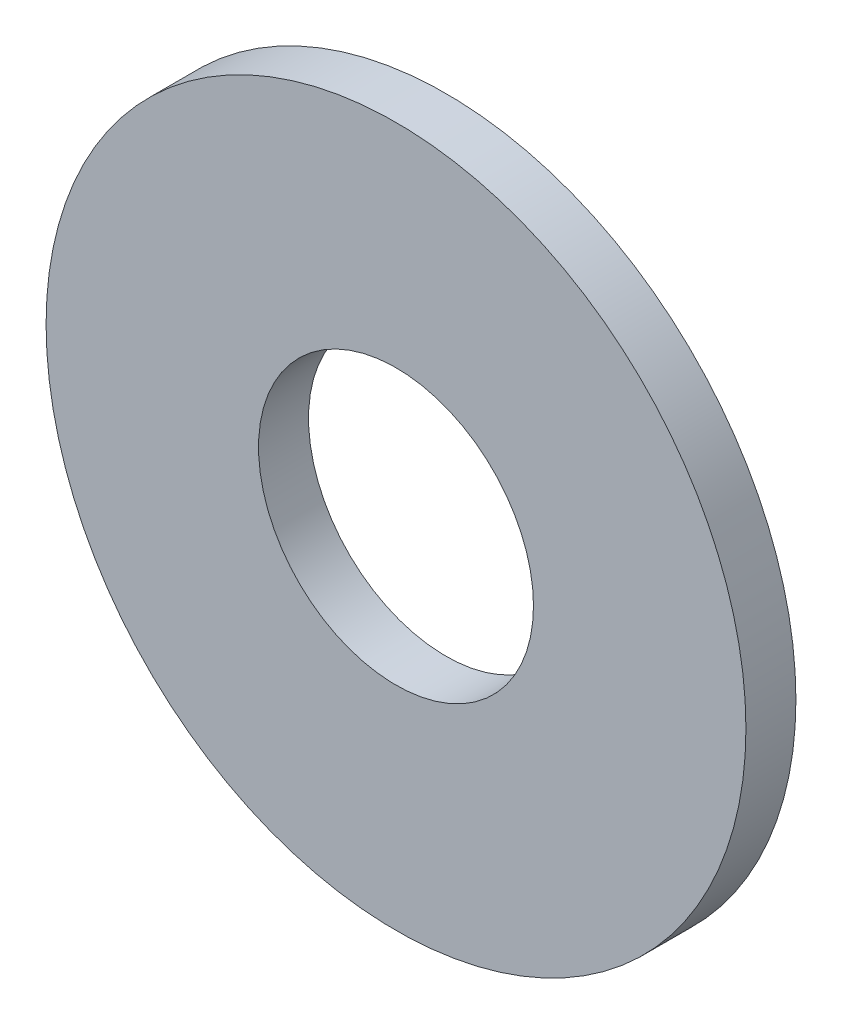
SolidWorks part; units mm, degrees
ref_plane "Plan de face" through (0, 0, 0) normal (0, 0, 1) x (1, 0, 0)
ref_plane "Plan de dessus" through (0, 0, 0) normal (0, 1, 0) x (1, 0, 0)
ref_plane "Plan de droite" through (0, 0, 0) normal (1, 0, 0) x (0, 0, -1)
sketch "Esquisse1" plane through (0, 0, 0) normal (0, 0, 1) x (1, 0, 0)
  circle A0 centre (0, 0) radius 14
  dimension "D1" = 28
extrude "Extrusion1" add sketch "Esquisse1" along normal blind 2
hole_wizard "Dégagement M101" positions "Esquisse3D4" profile "Esquisse5" hole size "M10" standard "ISO"
sketch3d "Esquisse3D4"
  line L0 (0, 0, 2) -> (0, 0, 0) construction
  point P0 (0, 0, 2)
sketch "Esquisse5" plane through (0, 0, 2) normal (1, 0, 0) x (0, -1, 0)
  line L0 (0, 0) -> (0, 13.3047)
  line L1 (0, 13.3047) -> (5.5, 10)
  line L2 (5.5, 10) -> (5.5, 0)
  line L5 (5.5, 0) -> (0, 0)
  line L10 (0, 13.3047) -> (-5.5, 10) construction
  line L11 (0, -6.35) -> (0, 107.95) construction
  dimension "Diamètre du perçage" = 11
  dimension "Profondeur du perçage" = 10
  dimension "Angle de pointe" = 118
sketch "Esquisse6" plane through (0, 0, 2) normal (0, 0, 1) x (1, 0, 0)
  line L1 (0, 5.5) -> (14, 5.5)
  line L2 (0, 5.5) -> (0, -5.5)
  line L3 (0, -5.5) -> (14, -5.5)
  line L4 (14, 5.5) -> (14, -5.5)
  circle A0 centre (0, 0) radius 5.5 construction
  circle A1 centre (0, 0) radius 14 construction
extrude "Extrusion2" [suppressed] cut sketch "Esquisse6" against normal blind 2
